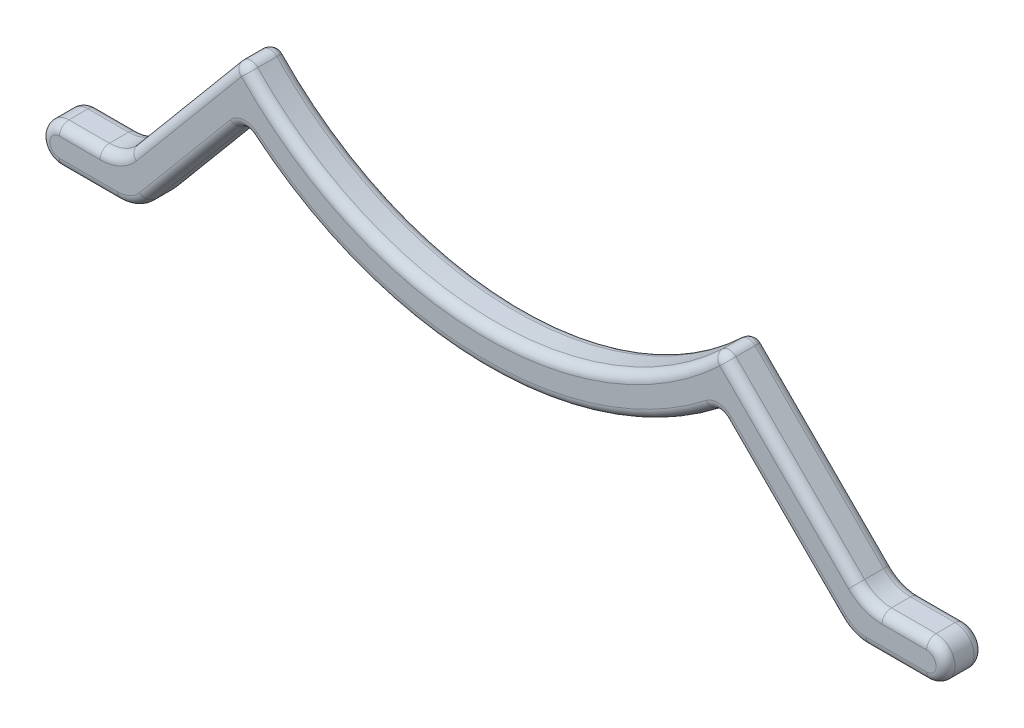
SolidWorks part; units mm, degrees
ref_plane "Front Plane" through (0, 0, 0) normal (0, 0, 1) x (1, 0, 0)
ref_plane "Top Plane" through (0, 0, 0) normal (0, 1, 0) x (1, 0, 0)
ref_plane "Right Plane" through (0, 0, 0) normal (1, 0, 0) x (0, 0, -1)
sketch "Sketch1" plane through (0, 0, 0) normal (0, 0, 1) x (1, 0, 0)
  line L0 (0, 0) -> (-2208.8847, 0) construction
  line L1 (0, 0) -> (0, 978.4972) construction
  line L2 (2278.7967, -2278.7967) -> (-2301.9494, 2301.9494) construction
  line L3 (-2262.0362, -2262.0362) -> (2682.3178, 2682.3178) construction
  line L4 (-1658.3301, -1508.9589) -> (-2349.122, -2334.5025)
  line L5 (-2540.8527, -2424.0676) -> (-2807.2825, -2424.0676)
  line L7 (-2807.2825, -2674.0676) -> (-2424.0676, -2674.0676)
  line L8 (-2232.3369, -2584.5025) -> (-1635.3851, -1871.1042)
  line L10 (1579.4119, -1579.4119) -> (2425.3828, -2425.3828)
  line L11 (2602.1595, -2498.6061) -> (2895.0527, -2498.6061)
  line L12 (2895.0527, -2748.6061) -> (2498.6061, -2748.6061)
  line L13 (2321.8294, -2675.3828) -> (1566.0779, -1919.6313)
  circle A0 centre (0, 0) radius 2172 construction
  arc A1 (-1565.3538, -1505.7395) -> (1492.277, -1578.1931) centre (0, 0) ccw
  arc A2 (-1547.5185, -1863.1345) -> (1483.5992, -1914.4235) centre (0, 0) ccw
  arc A3 (-2807.2825, -2424.0676) -> (-2807.2825, -2674.0676) centre (-2807.2825, -2549.0676) ccw
  arc A4 (2895.0527, -2498.6061) -> (2895.0527, -2748.6061) centre (2895.0527, -2623.6061) cw
  arc A5 (-1712.6126, -1712.6126) -> (1712.6126, -1712.6126) centre (0, 0) ccw construction
  arc A6 (2425.3828, -2425.3828) -> (2602.1595, -2498.6061) centre (2602.1595, -2248.6061) ccw
  arc A7 (2498.6061, -2748.6061) -> (2321.8294, -2675.3828) centre (2498.6061, -2498.6061) cw
  arc A8 (-2424.0676, -2674.0676) -> (-2232.3369, -2584.5025) centre (-2424.0676, -2424.0676) ccw
  arc A9 (-2349.122, -2334.5025) -> (-2540.8527, -2424.0676) centre (-2540.8527, -2174.0676) cw
  arc A10 (1566.0779, -1919.6313) -> (1483.5992, -1914.4235) centre (1521.8837, -1963.8254) ccw
  arc A11 (-1535.8359, -1535.8359) -> (1535.8359, -1535.8359) centre (0, 0) ccw construction
  arc A12 (1492.277, -1578.1931) -> (1579.4119, -1579.4119) centre (1535.2177, -1623.6061) cw
  arc A13 (-1635.3851, -1871.1042) -> (-1547.5185, -1863.1345) centre (-1587.4525, -1911.213) cw
  arc A14 (-1565.3538, -1505.7395) -> (-1658.3301, -1508.9589) centre (-1610.3974, -1549.0676) ccw
  point P11 (0, 0)
  point P14 (0, 0)
  point P24 (-2615.6751, -2674.0676)
  point P33 (2498.6061, -2498.6061)
  point P36 (2395.0527, -2748.6061)
  point P39 (-2307.2825, -2674.0676)
  point P42 (-2424.0676, -2424.0676)
  point P48 (1535.8359, -1535.8359)
  dimension "D1" = 4344
  dimension "D7" = 250
  dimension "D6" = 1000
  dimension "D8" = 250
  dimension "D11" = 500
  dimension "D14" = 62.5
  dimension "D15" = 5702.3352
  dimension "D13" = 250
  dimension "D2" = 45
  dimension "D3" = 45
  dimension "D4" = 250
  dimension "D5" = 1000
  dimension "D9" = 250
  dimension "D10" = 250
  dimension "D12" = 500
extrude "Boss-Extrude1" add sketch "Sketch1" along normal mid plane 250
fillet "Fillet1" radius 62.5 40 edges at (-2932.2825, -2549.0676, 125) (-2615.6751, -2674.0676, 125) (-2318.2582, -2650.5723, 125) (-1933.861, -2227.8034, 125) (-1593.0982, -1848.9685, 125) (-40.9763, -2421.6533, 125) (1525.8221, -1901.4496, 125) (1943.9536, -2297.507, 125) (2402.9352, -2729.576, 125) (2696.8294, -2748.6061, 125) (3020.0527, -2623.6061, 125) (2748.6061, -2498.6061, 125) (2506.4886, -2479.576, 125) (2002.3974, -2002.3974, 125) (1536.0919, -1561.1122, 125) (-51.4533, -2171.3905, 125) (-1612.5602, -1486.605, 125) (-2003.726, -1921.7307, 125) (-2435.0432, -2400.5723, 125) (-2674.0676, -2424.0676, 125) (-2932.2825, -2549.0676, -125) (-2615.6751, -2674.0676, -125) (-2318.2582, -2650.5723, -125) (-2435.0432, -2400.5723, -125) (-2674.0676, -2424.0676, -125) (-1933.861, -2227.8034, -125) (-1593.0982, -1848.9685, -125) (-2003.726, -1921.7307, -125) (-1612.5602, -1486.605, -125) (-51.4533, -2171.3905, -125) (1536.0919, -1561.1122, -125) (-40.9763, -2421.6533, -125) (1525.8221, -1901.4496, -125) (1943.9536, -2297.507, -125) (2402.9352, -2729.576, -125) (2696.8294, -2748.6061, -125) (3020.0527, -2623.6061, -125) (2506.4886, -2479.576, -125) (2748.6061, -2498.6061, -125) (2002.3974, -2002.3974, -125)
